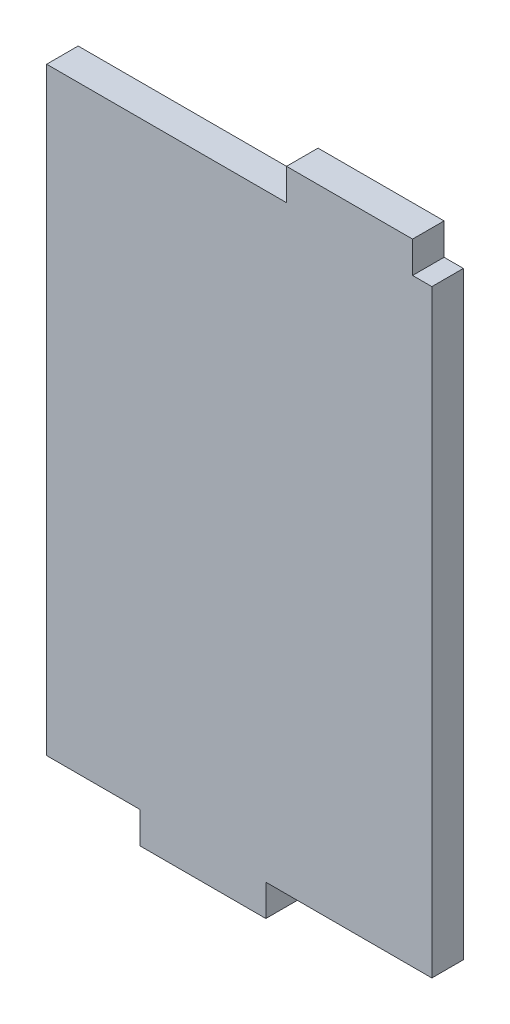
SolidWorks part; units mm, degrees
ref_plane "Front Plane" through (0, 0, 0) normal (0, 0, 1) x (1, 0, 0)
ref_plane "Top Plane" through (0, 0, 0) normal (0, 1, 0) x (1, 0, 0)
ref_plane "Right Plane" through (0, 0, 0) normal (1, 0, 0) x (0, 0, -1)
sketch "Sketch1" plane through (0, 0, 0) normal (0, 0, 1) x (1, 0, 0)
  line L0 (20.8422, 87.9243) -> (34.591, 74.1756) construction
  line L1 (0, 0) -> (198.12, 0) construction
  line L2 (0, 0) -> (0, 105) construction
  line L3 (0, 105) -> (198.12, 105) construction
  line L4 (198.12, 0) -> (198.12, 105) construction
  line L5 (34.591, 74.1756) -> (48.3398, 87.9243) construction
  line L6 (5, 105) -> (5, 0) construction
  line L7 (0, 0) -> (0, 45) construction
  line L8 (0, 45) -> (5, 45) construction
  line L9 (5, 45) -> (5, 65) construction
  line L10 (5, 65) -> (0, 65) construction
  line L11 (0, 65) -> (0, 85) construction
  line L12 (0, 85) -> (5, 85) construction
  line L13 (5, 85) -> (5, 105) construction
  line L14 (5, 105) -> (60, 105) construction
  line L15 (60, 105) -> (60, 100) construction
  line L16 (60, 100) -> (106.56, 100) construction
  line L17 (106.56, 100) -> (106.56, 105)
  line L18 (106.56, 105) -> (126.56, 105)
  line L19 (126.56, 105) -> (126.56, 100)
  line L20 (126.56, 100) -> (173.12, 100) construction
  line L21 (173.12, 100) -> (173.12, 105) construction
  line L22 (173.12, 105) -> (193.12, 105) construction
  line L23 (193.12, 105) -> (193.12, 85) construction
  line L24 (193.12, 85) -> (198.12, 85) construction
  line L25 (198.12, 85) -> (198.12, 65) construction
  line L26 (198.12, 65) -> (193.12, 65) construction
  line L27 (193.12, 65) -> (193.12, 45) construction
  line L28 (193.12, 45) -> (198.12, 45) construction
  line L29 (198.12, 45) -> (198.12, 0) construction
  line L30 (0, 0) -> (60, 0) construction
  line L31 (60, 0) -> (60, 5) construction
  line L32 (60, 5) -> (83.28, 5) construction
  line L33 (83.28, 5) -> (83.28, 0)
  line L34 (83.28, 0) -> (103.28, 0)
  line L35 (103.28, 0) -> (103.28, 5)
  line L36 (103.28, 5) -> (126.56, 5)
  line L37 (126.56, 5) -> (126.56, 0) construction
  line L38 (126.56, 0) -> (198.12, 0) construction
  line L39 (68.5, 5) -> (68.5, 100)
  line L40 (129.62, 0) -> (129.62, 100) construction
  line L41 (63.5, 100) -> (63.5, 5) construction
  line L42 (134.62, 100) -> (134.62, 0) construction
  line L43 (126.56, 5) -> (129.62, 5)
  line L44 (129.62, 5) -> (129.62, 100)
  line L45 (83.28, 5) -> (68.5, 5)
  line L46 (68.5, 100) -> (106.56, 100)
  line L47 (126.56, 100) -> (129.62, 100)
  circle A0 centre (31.75, 20) radius 14 construction
  circle A1 centre (80.01, 46.3813) radius 14 construction
  circle A2 centre (118.11, 46.3813) radius 14 construction
  circle A3 centre (166.37, 20) radius 14 construction
  circle A4 centre (31.75, 20) radius 55 construction
  circle A5 centre (31.75, 20) radius 31.75 construction
  circle A6 centre (166.37, 20) radius 55 construction
  circle A7 centre (166.37, 20) radius 31.75 construction
  circle A8 centre (31.75, 20) radius 54.25 construction
  circle A9 centre (34.591, 74.1756) radius 19.4437 construction
  circle A10 centre (20.8422, 87.9243) radius 3 construction
  circle A11 centre (20.8422, 60.4268) radius 3 construction
  circle A12 centre (48.3398, 60.4268) radius 3 construction
  circle A13 centre (48.3398, 87.9243) radius 3 construction
  circle A14 centre (34.591, 74.1756) radius 29.591 construction
  circle A15 centre (34.591, 74.1756) radius 13 construction
  dimension "D1" = 63.5
  dimension "D5" = 110
  dimension "D8" = 108.5
  dimension "D9" = 38.8874
  dimension "D10" = 6
  dimension "D11" = 59.182
  dimension "D21" = 26
  dimension "D23" = 28
  dimension "D24" = 28
  dimension "D3" = 38.1
  dimension "D4" = 134.62
  dimension "D6" = 198.12
  dimension "D7" = 105
  dimension "D12" = 20
  dimension "D13" = 5
  dimension "D14" = 20
  dimension "D15" = 20
  dimension "D16" = 45
  dimension "D17" = 20
  dimension "D18" = 20
  dimension "D19" = 55
  dimension "D20" = 5
  dimension "D22" = 20
  dimension "D25" = 5
  dimension "D26" = 5
extrude "Boss-Extrude1" add sketch "Sketch1" along normal blind 5
